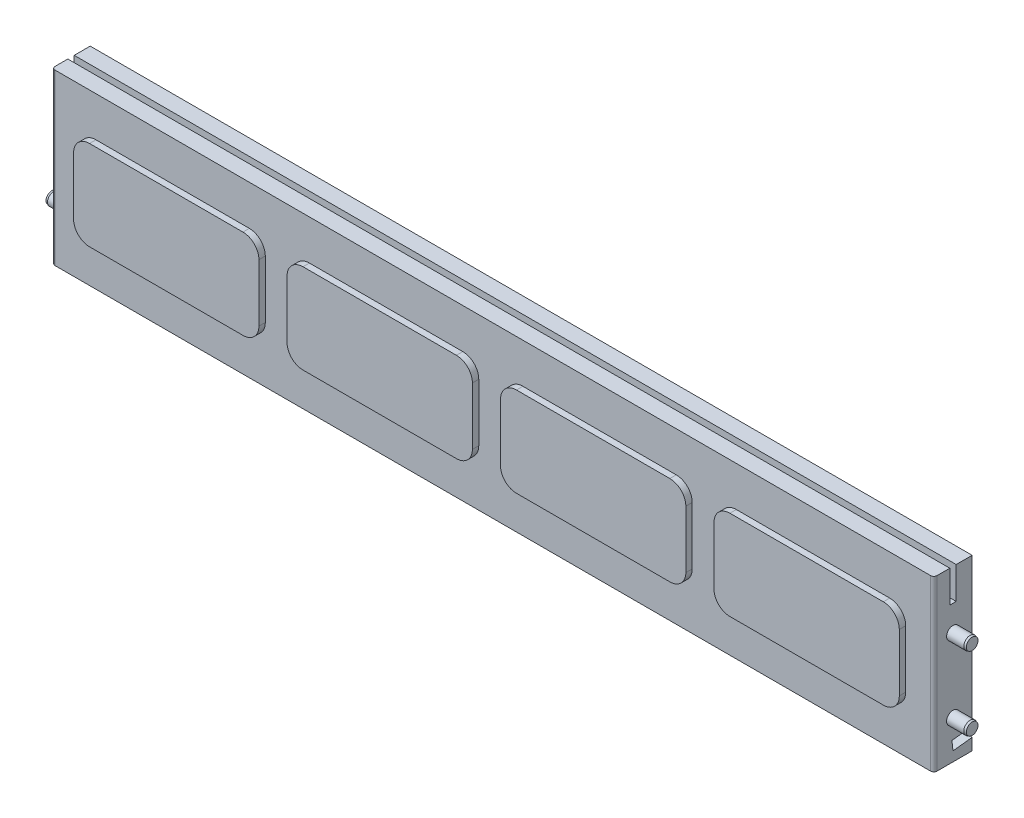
SolidWorks part; units mm, degrees
ref_plane "Front Plane" through (0, 0, 0) normal (0, 0, 1) x (1, 0, 0)
ref_plane "Top Plane" through (0, 0, 0) normal (0, 1, 0) x (1, 0, 0)
ref_plane "Right Plane" through (0, 0, 0) normal (1, 0, 0) x (0, 0, -1)
body saved out of another part "Stock-Donut Shop-1"
hole_wizard "CBORE for M4 Pan Head Machine Screw" positions "3DSketch1" profile "Sketch1" counterbore size "M4" standard "ANSI Metric"
sketch3d "3DSketch1"
  point P0 (-240, 216, -84)
  point P3 (-240, 47, -99)
  point P6 (-240, 6, -99)
  point P9 (-240, 47, 99)
  point P12 (-240, 6, 99)
sketch "Sketch1" plane through (-240, 216, -84) normal (0, 1, 0) x (0, 0, 1)
  line L0 (0, 0) -> (0, 30)
  line L1 (0, 30) -> (2.25, 28.6481)
  line L2 (2.25, 28.6481) -> (2.25, 3.1)
  line L3 (2.25, 3.1) -> (4.5, 3.1)
  line L4 (4.5, 3.1) -> (4.5, 0)
  line L5 (4.5, 0) -> (0, 0)
  line L6 (0, 30) -> (-2.25, 28.6481) construction
  line L7 (0, -6.35) -> (0, 107.95) construction
  dimension "Hole Dia." = 4.5
  dimension "Hole Depth" = 30
  dimension "C'Bore Dia." = 9
  dimension "C'Bore Depth" = 3.1
  dimension "Drill Angle" = 118
hole_wizard "Ø4.0mm Dowel Hole1" positions "3DSketch2" profile "Sketch2" hole size "Ø4.0" standard "ANSI Metric"
sketch3d "3DSketch2"
  point P0 (48, 47, -99)
  point P3 (48, 47, 99)
  point P6 (48, 216, -84)
  point P9 (48, 24, -99)
  point P13 (48, 24, 99)
sketch "Sketch2" plane through (48, 47, -99) normal (0, 1, 0) x (0, 0, 1)
  line L0 (0, 0) -> (0, 6)
  line L1 (0, 6) -> (2, 6)
  line L2 (2, 6) -> (2, 0)
  line L3 (2, 0) -> (0, 0)
  line L4 (0, 6) -> (-2, 6) construction
  line L5 (0, -6.35) -> (0, 107.95) construction
  dimension "Hole Dia." = 4
  dimension "Hole Depth" = 6
  dimension "Drill Angle" = 180
hole_wizard "Ø4.0mm Dowel Hole2" positions "3DSketch3" profile "Sketch3" hole size "Ø4.0" standard "ANSI Metric"
sketch3d "3DSketch3"
  point P0 (48, 47, -99)
  point P4 (48, 47, 99)
  point P8 (48, 216, -84)
  point P11 (48, 24, -99)
  point P14 (48, 24, 99)
sketch "Sketch3" plane through (48, 47, -99) normal (0, 1, 0) x (0, 0, -1)
  line L0 (0, 0) -> (0, 14)
  line L1 (0, 14) -> (2, 14)
  line L2 (2, 14) -> (2, 0)
  line L3 (2, 0) -> (0, 0)
  line L4 (0, 14) -> (-2, 14) construction
  line L5 (0, -6.35) -> (0, 107.95) construction
  dimension "Hole Dia." = 4
  dimension "Hole Depth" = 14
  dimension "Drill Angle" = 180
hole_wizard "Ø4.0mm Dowel Hole3" positions "3DSketch4" profile "Sketch4" hole size "Ø4.0" standard "ANSI Metric"
sketch3d "3DSketch4"
  point P0 (-228, 24, -99)
  point P3 (-228, 24, 99)
sketch "Sketch4" plane through (-228, 24, -99) normal (0, 1, 0) x (0, 0, -1)
  line L0 (0, 0) -> (0, 6)
  line L1 (0, 6) -> (2, 6)
  line L2 (2, 6) -> (2, 0)
  line L3 (2, 0) -> (0, 0)
  line L4 (0, 6) -> (-2, 6) construction
  line L5 (0, -6.35) -> (0, 107.95) construction
  dimension "Hole Dia." = 4
  dimension "Hole Depth" = 6
  dimension "Drill Angle" = 180
fillet "Fillet1" radius 1 2 edges at (48, 38.5, 105) (-228, 38.5, 105)
hole_wizard "Ø4.0mm Dowel Hole4" positions "3DSketch5" profile "Sketch5" hole size "Ø4.0" standard "ANSI Metric"
sketch3d "3DSketch5"
  point P0 (-228, 24, -99)
  point P3 (-228, 24, 99)
sketch "Sketch5" plane through (-228, 24, -99) normal (0, 1, 0) x (0, 0, 1)
  line L0 (0, 0) -> (0, 14)
  line L1 (0, 14) -> (2, 14)
  line L2 (2, 14) -> (2, 0)
  line L3 (2, 0) -> (0, 0)
  line L4 (0, 14) -> (-2, 14) construction
  line L5 (0, -6.35) -> (0, 107.95) construction
  dimension "Hole Dia." = 4
  dimension "Hole Depth" = 14
  dimension "Drill Angle" = 180
inserted part "parallel pin hardened_bsi"
move or copy body "Body-Move/Copy5" placed by mates yes
inserted part "parallel pin hardened_bsi1"
move or copy body "Body-Move/Copy7" placed by mates yes
inserted part "parallel pin hardened_bsi2"
move or copy body "Body-Move/Copy9" placed by mates yes
